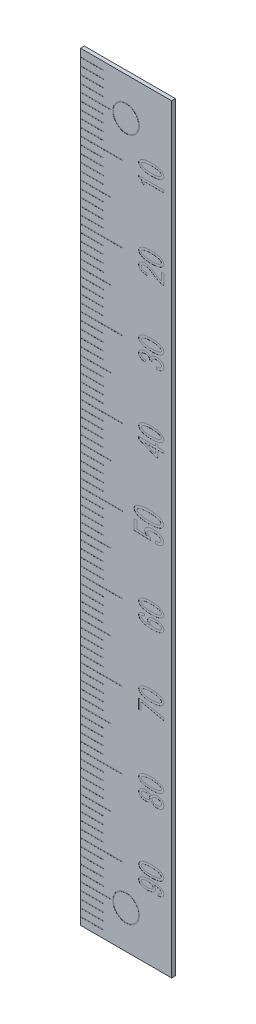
SolidWorks part; units mm, degrees
ref_plane "Front" through (0, 0, 0) normal (0, 0, 1) x (1, 0, 0)
ref_plane "Top" through (0, 0, 0) normal (0, 1, 0) x (1, 0, 0)
ref_plane "Right" through (0, 0, 0) normal (1, 0, 0) x (0, 0, -1)
sketch "Sketch1" plane through (0, 0, 0) normal (0, 0, 1) x (1, 0, 0)
  line L1 (0, 0) -> (0, 100)
  line L2 (0, 0) -> (12, 0)
  line L3 (12, 0) -> (12, 100)
  line L4 (0, 100) -> (12, 100)
  dimension "D1" = 100
  dimension "D2" = 12
extrude "Extrude1" add sketch "Sketch1" along normal blind 0.5
sketch "Sketch2" plane through (0, 0, 0.5) normal (0, 0, 1) x (1, 0, 0)
  line L0 (0, 100) -> (0, 0) construction
  line L1 (0, 0) -> (12, 0) construction
  line L2 (12, 100) -> (0, 100) construction
  circle A0 centre (6, 5) radius 1.75
  circle A1 centre (6, 95) radius 1.75
  circle A2 centre (6, 5) radius 1.65
  circle A3 centre (6, 95) radius 1.65
  dimension "D1" = 6
  dimension "D2" = 6
  dimension "D3" = 5
  dimension "D4" = 5
  dimension "D5" = 3.5
  dimension "D6" = 3.5
  dimension "D7" = 0.1
extrude "Extrude2" cut sketch "Sketch2" against normal blind 0.01
sketch "Sketch3" plane through (0, 0, 0.5) normal (0, 0, 1) x (1, 0, 0)
  line L0 (12, 100) -> (0, 100) construction
  line L1 (7.5, 88.25) -> (11, 88.25) construction
  line L2 (7.5, 88.25) -> (7.5, 91.75) construction
  line L3 (7.5, 91.75) -> (11, 91.75) construction
  line L4 (11, 88.25) -> (11, 91.75) construction
  line L6 (11, 78.25) -> (11, 81.75) construction
  line L7 (11, 68.25) -> (11, 71.75) construction
  line L8 (11, 58.25) -> (11, 61.75) construction
  line L9 (11, 48.25) -> (11, 51.75) construction
  line L10 (11, 38.25) -> (11, 41.75) construction
  line L11 (11, 28.25) -> (11, 31.75) construction
  line L12 (11, 18.25) -> (11, 21.75) construction
  line L13 (11, 8.25) -> (11, 11.75) construction
  line L15 (12, 0) -> (12, 100) construction
  line L16 (11, -1.75) -> (11, 1.75) construction
  text T0 "10" font "ＭＳ ゴシック" height in points 11
  text T1 "20" font "ＭＳ ゴシック" height in points 11
  text T2 "30" font "ＭＳ ゴシック" height in points 11
  text T3 "40" font "ＭＳ ゴシック" height in points 11
  text T4 "50" font "ＭＳ ゴシック" height in points 13
  text T5 "60  " font "ＭＳ ゴシック" height in points 11
  text T6 "70" font "ＭＳ ゴシック" height in points 11
  text T7 "80" font "ＭＳ ゴシック" height in points 11
  text T8 "90" font "ＭＳ ゴシック" height in points 11
  point P4 (11, 90)
  dimension "D1" = 3.5
  dimension "D2" = 10
  dimension "D3" = 1
  dimension "D4" = 3.5
  dimension "D5" = 4
  dimension "D6" = 7
extrude "Extrude3" cut sketch "Sketch3" against normal blind 0.01
sketch "Sketch4" plane through (0, 0, 0.5) normal (0, 0, 1) x (1, 0, 0)
  line L5 (12, 100) -> (0, 100) construction
  line L406 (6, 100) -> (6, 0) construction
  line L407 (0, 0) -> (12, 0) construction
  line L408 (3, 1.05) -> (3, 0.95)
  line L409 (0, 0.95) -> (3, 0.95)
  line L410 (0, 1.05) -> (3, 1.05)
  line L411 (0, 1.05) -> (0, 0.95)
  line L412 (3, 2.05) -> (3, 1.95)
  line L413 (0, 1.95) -> (3, 1.95)
  line L414 (0, 2.05) -> (3, 2.05)
  line L415 (0, 2.05) -> (0, 1.95)
  line L416 (3, 3.05) -> (3, 2.95)
  line L417 (0, 2.95) -> (3, 2.95)
  line L418 (0, 3.05) -> (3, 3.05)
  line L419 (0, 3.05) -> (0, 2.95)
  line L420 (3, 4.05) -> (3, 3.95)
  line L421 (0, 3.95) -> (3, 3.95)
  line L422 (0, 4.05) -> (3, 4.05)
  line L423 (0, 4.05) -> (0, 3.95)
  line L424 (3, 6.05) -> (3, 5.95)
  line L425 (0, 5.95) -> (3, 5.95)
  line L426 (0, 6.05) -> (3, 6.05)
  line L427 (0, 6.05) -> (0, 5.95)
  line L428 (3, 7.05) -> (3, 6.95)
  line L429 (0, 6.95) -> (3, 6.95)
  line L430 (0, 7.05) -> (3, 7.05)
  line L431 (0, 7.05) -> (0, 6.95)
  line L432 (3, 8.05) -> (3, 7.95)
  line L433 (0, 7.95) -> (3, 7.95)
  line L434 (0, 8.05) -> (3, 8.05)
  line L435 (3, 9.05) -> (3, 8.95)
  line L436 (0, 8.95) -> (3, 8.95)
  line L437 (0, 9.05) -> (0, 8.95)
  line L438 (0, 9.05) -> (3, 9.05)
  line L439 (4, 4.95) -> (4, 5.05)
  line L440 (0, 5.05) -> (4, 5.05)
  line L441 (0, 4.95) -> (0, 5.05)
  line L442 (0, 4.95) -> (4, 4.95)
  line L443 (0, 8.05) -> (0, 7.95)
  line L444 (0, 9.95) -> (0, 10.05)
  line L445 (5.5, 9.95) -> (0, 9.95)
  line L446 (5.5, 10.05) -> (5.5, 9.95)
  line L447 (0, 10.05) -> (5.5, 10.05)
  line L448 (3, 11.05) -> (3, 10.95)
  line L449 (0, 10.95) -> (3, 10.95)
  line L450 (0, 11.05) -> (3, 11.05)
  line L451 (0, 11.05) -> (0, 10.95)
  line L452 (3, 12.05) -> (3, 11.95)
  line L453 (0, 11.95) -> (3, 11.95)
  line L454 (0, 12.05) -> (3, 12.05)
  line L455 (0, 12.05) -> (0, 11.95)
  line L456 (3, 13.05) -> (3, 12.95)
  line L457 (0, 12.95) -> (3, 12.95)
  line L458 (0, 13.05) -> (3, 13.05)
  line L459 (0, 13.05) -> (0, 12.95)
  line L460 (3, 14.05) -> (3, 13.95)
  line L461 (0, 13.95) -> (3, 13.95)
  line L462 (0, 14.05) -> (3, 14.05)
  line L463 (0, 14.05) -> (0, 13.95)
  line L464 (3, 16.05) -> (3, 15.95)
  line L465 (0, 15.95) -> (3, 15.95)
  line L466 (0, 16.05) -> (3, 16.05)
  line L467 (0, 16.05) -> (0, 15.95)
  line L468 (3, 17.05) -> (3, 16.95)
  line L469 (0, 16.95) -> (3, 16.95)
  line L470 (0, 17.05) -> (3, 17.05)
  line L471 (0, 17.05) -> (0, 16.95)
  line L472 (3, 18.05) -> (3, 17.95)
  line L473 (0, 17.95) -> (3, 17.95)
  line L474 (0, 18.05) -> (3, 18.05)
  line L475 (3, 19.05) -> (3, 18.95)
  line L476 (0, 18.95) -> (3, 18.95)
  line L477 (0, 19.05) -> (0, 18.95)
  line L478 (0, 19.05) -> (3, 19.05)
  line L479 (4, 14.95) -> (4, 15.05)
  line L480 (0, 15.05) -> (4, 15.05)
  line L481 (0, 14.95) -> (0, 15.05)
  line L482 (0, 14.95) -> (4, 14.95)
  line L483 (0, 18.05) -> (0, 17.95)
  line L484 (0, 19.95) -> (0, 20.05)
  line L485 (5.5, 19.95) -> (0, 19.95)
  line L486 (5.5, 20.05) -> (5.5, 19.95)
  line L487 (0, 20.05) -> (5.5, 20.05)
  line L488 (3, 21.05) -> (3, 20.95)
  line L489 (0, 20.95) -> (3, 20.95)
  line L490 (0, 21.05) -> (3, 21.05)
  line L491 (0, 21.05) -> (0, 20.95)
  line L492 (3, 22.05) -> (3, 21.95)
  line L493 (0, 21.95) -> (3, 21.95)
  line L494 (0, 22.05) -> (3, 22.05)
  line L495 (0, 22.05) -> (0, 21.95)
  line L496 (3, 23.05) -> (3, 22.95)
  line L497 (0, 22.95) -> (3, 22.95)
  line L498 (0, 23.05) -> (3, 23.05)
  line L499 (0, 23.05) -> (0, 22.95)
  line L500 (3, 24.05) -> (3, 23.95)
  line L501 (0, 23.95) -> (3, 23.95)
  line L502 (0, 24.05) -> (3, 24.05)
  line L503 (0, 24.05) -> (0, 23.95)
  line L504 (3, 26.05) -> (3, 25.95)
  line L505 (0, 25.95) -> (3, 25.95)
  line L506 (0, 26.05) -> (3, 26.05)
  line L507 (0, 26.05) -> (0, 25.95)
  line L508 (3, 27.05) -> (3, 26.95)
  line L509 (0, 26.95) -> (3, 26.95)
  line L510 (0, 27.05) -> (3, 27.05)
  line L511 (0, 27.05) -> (0, 26.95)
  line L512 (3, 28.05) -> (3, 27.95)
  line L513 (0, 27.95) -> (3, 27.95)
  line L514 (0, 28.05) -> (3, 28.05)
  line L515 (3, 29.05) -> (3, 28.95)
  line L516 (0, 28.95) -> (3, 28.95)
  line L517 (0, 29.05) -> (0, 28.95)
  line L518 (0, 29.05) -> (3, 29.05)
  line L519 (4, 24.95) -> (4, 25.05)
  line L520 (0, 25.05) -> (4, 25.05)
  line L521 (0, 24.95) -> (0, 25.05)
  line L522 (0, 24.95) -> (4, 24.95)
  line L523 (0, 28.05) -> (0, 27.95)
  line L524 (0, 29.95) -> (0, 30.05)
  line L525 (5.5, 29.95) -> (0, 29.95)
  line L526 (5.5, 30.05) -> (5.5, 29.95)
  line L527 (0, 30.05) -> (5.5, 30.05)
  line L528 (3, 31.05) -> (3, 30.95)
  line L529 (0, 30.95) -> (3, 30.95)
  line L530 (0, 31.05) -> (3, 31.05)
  line L531 (0, 31.05) -> (0, 30.95)
  line L532 (3, 32.05) -> (3, 31.95)
  line L533 (0, 31.95) -> (3, 31.95)
  line L534 (0, 32.05) -> (3, 32.05)
  line L535 (0, 32.05) -> (0, 31.95)
  line L536 (3, 33.05) -> (3, 32.95)
  line L537 (0, 32.95) -> (3, 32.95)
  line L538 (0, 33.05) -> (3, 33.05)
  line L539 (0, 33.05) -> (0, 32.95)
  line L540 (3, 34.05) -> (3, 33.95)
  line L541 (0, 33.95) -> (3, 33.95)
  line L542 (0, 34.05) -> (3, 34.05)
  line L543 (0, 34.05) -> (0, 33.95)
  line L544 (3, 36.05) -> (3, 35.95)
  line L545 (0, 35.95) -> (3, 35.95)
  line L546 (0, 36.05) -> (3, 36.05)
  line L547 (0, 36.05) -> (0, 35.95)
  line L548 (3, 37.05) -> (3, 36.95)
  line L549 (0, 36.95) -> (3, 36.95)
  line L550 (0, 37.05) -> (3, 37.05)
  line L551 (0, 37.05) -> (0, 36.95)
  line L552 (3, 38.05) -> (3, 37.95)
  line L553 (0, 37.95) -> (3, 37.95)
  line L554 (0, 38.05) -> (3, 38.05)
  line L555 (3, 39.05) -> (3, 38.95)
  line L556 (0, 38.95) -> (3, 38.95)
  line L557 (0, 39.05) -> (0, 38.95)
  line L558 (0, 39.05) -> (3, 39.05)
  line L559 (4, 34.95) -> (4, 35.05)
  line L560 (0, 35.05) -> (4, 35.05)
  line L561 (0, 34.95) -> (0, 35.05)
  line L562 (0, 34.95) -> (4, 34.95)
  line L563 (0, 38.05) -> (0, 37.95)
  line L564 (0, 39.95) -> (0, 40.05)
  line L565 (5.5, 39.95) -> (0, 39.95)
  line L566 (5.5, 40.05) -> (5.5, 39.95)
  line L567 (0, 40.05) -> (5.5, 40.05)
  line L568 (3, 41.05) -> (3, 40.95)
  line L569 (0, 40.95) -> (3, 40.95)
  line L570 (0, 41.05) -> (3, 41.05)
  line L571 (0, 41.05) -> (0, 40.95)
  line L572 (3, 42.05) -> (3, 41.95)
  line L573 (0, 41.95) -> (3, 41.95)
  line L574 (0, 42.05) -> (3, 42.05)
  line L575 (0, 42.05) -> (0, 41.95)
  line L576 (3, 43.05) -> (3, 42.95)
  line L577 (0, 42.95) -> (3, 42.95)
  line L578 (0, 43.05) -> (3, 43.05)
  line L579 (0, 43.05) -> (0, 42.95)
  line L580 (3, 44.05) -> (3, 43.95)
  line L581 (0, 43.95) -> (3, 43.95)
  line L582 (0, 44.05) -> (3, 44.05)
  line L583 (0, 44.05) -> (0, 43.95)
  line L584 (3, 46.05) -> (3, 45.95)
  line L585 (0, 45.95) -> (3, 45.95)
  line L586 (0, 46.05) -> (3, 46.05)
  line L587 (0, 46.05) -> (0, 45.95)
  line L588 (3, 47.05) -> (3, 46.95)
  line L589 (0, 46.95) -> (3, 46.95)
  line L590 (0, 47.05) -> (3, 47.05)
  line L591 (0, 47.05) -> (0, 46.95)
  line L592 (3, 48.05) -> (3, 47.95)
  line L593 (0, 47.95) -> (3, 47.95)
  line L594 (0, 48.05) -> (3, 48.05)
  line L595 (3, 49.05) -> (3, 48.95)
  line L596 (0, 48.95) -> (3, 48.95)
  line L597 (0, 49.05) -> (0, 48.95)
  line L598 (0, 49.05) -> (3, 49.05)
  line L599 (4, 44.95) -> (4, 45.05)
  line L600 (0, 45.05) -> (4, 45.05)
  line L601 (0, 44.95) -> (0, 45.05)
  line L602 (0, 44.95) -> (4, 44.95)
  line L603 (0, 48.05) -> (0, 47.95)
  line L604 (3, 51.05) -> (3, 50.95)
  line L605 (0, 50.95) -> (3, 50.95)
  line L606 (0, 51.05) -> (3, 51.05)
  line L607 (0, 51.05) -> (0, 50.95)
  line L608 (3, 52.05) -> (3, 51.95)
  line L609 (0, 51.95) -> (3, 51.95)
  line L610 (0, 52.05) -> (3, 52.05)
  line L611 (0, 52.05) -> (0, 51.95)
  line L612 (3, 53.05) -> (3, 52.95)
  line L613 (0, 52.95) -> (3, 52.95)
  line L614 (0, 53.05) -> (3, 53.05)
  line L615 (0, 53.05) -> (0, 52.95)
  line L616 (3, 54.05) -> (3, 53.95)
  line L617 (0, 53.95) -> (3, 53.95)
  line L618 (0, 54.05) -> (3, 54.05)
  line L619 (0, 54.05) -> (0, 53.95)
  line L620 (3, 56.05) -> (3, 55.95)
  line L621 (0, 55.95) -> (3, 55.95)
  line L622 (0, 56.05) -> (3, 56.05)
  line L623 (0, 56.05) -> (0, 55.95)
  line L624 (3, 57.05) -> (3, 56.95)
  line L625 (0, 56.95) -> (3, 56.95)
  line L626 (0, 57.05) -> (3, 57.05)
  line L627 (0, 57.05) -> (0, 56.95)
  line L628 (3, 58.05) -> (3, 57.95)
  line L629 (0, 57.95) -> (3, 57.95)
  line L630 (0, 58.05) -> (3, 58.05)
  line L631 (3, 59.05) -> (3, 58.95)
  line L632 (0, 58.95) -> (3, 58.95)
  line L633 (0, 59.05) -> (0, 58.95)
  line L634 (0, 59.05) -> (3, 59.05)
  line L635 (4, 54.95) -> (4, 55.05)
  line L636 (0, 55.05) -> (4, 55.05)
  line L637 (0, 54.95) -> (0, 55.05)
  line L638 (0, 54.95) -> (4, 54.95)
  line L639 (0, 58.05) -> (0, 57.95)
  line L640 (0, 49.95) -> (0, 50.05)
  line L641 (5.5, 49.95) -> (0, 49.95)
  line L642 (5.5, 50.05) -> (5.5, 49.95)
  line L643 (0, 50.05) -> (5.5, 50.05)
  line L644 (3, 61.05) -> (3, 60.95)
  line L645 (0, 60.95) -> (3, 60.95)
  line L646 (0, 61.05) -> (3, 61.05)
  line L647 (0, 61.05) -> (0, 60.95)
  line L648 (3, 62.05) -> (3, 61.95)
  line L649 (0, 61.95) -> (3, 61.95)
  line L650 (0, 62.05) -> (3, 62.05)
  line L651 (0, 62.05) -> (0, 61.95)
  line L652 (3, 63.05) -> (3, 62.95)
  line L653 (0, 62.95) -> (3, 62.95)
  line L654 (0, 63.05) -> (3, 63.05)
  line L655 (0, 63.05) -> (0, 62.95)
  line L656 (3, 64.05) -> (3, 63.95)
  line L657 (0, 63.95) -> (3, 63.95)
  line L658 (0, 64.05) -> (3, 64.05)
  line L659 (0, 64.05) -> (0, 63.95)
  line L660 (3, 66.05) -> (3, 65.95)
  line L661 (0, 65.95) -> (3, 65.95)
  line L662 (0, 66.05) -> (3, 66.05)
  line L663 (0, 66.05) -> (0, 65.95)
  line L664 (3, 67.05) -> (3, 66.95)
  line L665 (0, 66.95) -> (3, 66.95)
  line L666 (0, 67.05) -> (3, 67.05)
  line L667 (0, 67.05) -> (0, 66.95)
  line L668 (3, 68.05) -> (3, 67.95)
  line L669 (0, 67.95) -> (3, 67.95)
  line L670 (0, 68.05) -> (3, 68.05)
  line L671 (3, 69.05) -> (3, 68.95)
  line L672 (0, 68.95) -> (3, 68.95)
  line L673 (0, 69.05) -> (0, 68.95)
  line L674 (0, 69.05) -> (3, 69.05)
  line L675 (4, 64.95) -> (4, 65.05)
  line L676 (0, 65.05) -> (4, 65.05)
  line L677 (0, 64.95) -> (0, 65.05)
  line L678 (0, 64.95) -> (4, 64.95)
  line L679 (0, 68.05) -> (0, 67.95)
  line L680 (0, 59.95) -> (0, 60.05)
  line L681 (5.5, 59.95) -> (0, 59.95)
  line L682 (5.5, 60.05) -> (5.5, 59.95)
  line L683 (0, 60.05) -> (5.5, 60.05)
  line L684 (3, 71.05) -> (3, 70.95)
  line L685 (0, 70.95) -> (3, 70.95)
  line L686 (0, 71.05) -> (3, 71.05)
  line L687 (0, 71.05) -> (0, 70.95)
  line L688 (3, 72.05) -> (3, 71.95)
  line L689 (0, 71.95) -> (3, 71.95)
  line L690 (0, 72.05) -> (3, 72.05)
  line L691 (0, 72.05) -> (0, 71.95)
  line L692 (3, 73.05) -> (3, 72.95)
  line L693 (0, 72.95) -> (3, 72.95)
  line L694 (0, 73.05) -> (3, 73.05)
  line L695 (0, 73.05) -> (0, 72.95)
  line L696 (3, 74.05) -> (3, 73.95)
  line L697 (0, 73.95) -> (3, 73.95)
  line L698 (0, 74.05) -> (3, 74.05)
  line L699 (0, 74.05) -> (0, 73.95)
  line L700 (3, 76.05) -> (3, 75.95)
  line L701 (0, 75.95) -> (3, 75.95)
  line L702 (0, 76.05) -> (3, 76.05)
  line L703 (0, 76.05) -> (0, 75.95)
  line L704 (3, 77.05) -> (3, 76.95)
  line L705 (0, 76.95) -> (3, 76.95)
  line L706 (0, 77.05) -> (3, 77.05)
  line L707 (0, 77.05) -> (0, 76.95)
  line L708 (3, 78.05) -> (3, 77.95)
  line L709 (0, 77.95) -> (3, 77.95)
  line L710 (0, 78.05) -> (3, 78.05)
  line L711 (3, 79.05) -> (3, 78.95)
  line L712 (0, 78.95) -> (3, 78.95)
  line L713 (0, 79.05) -> (0, 78.95)
  line L714 (0, 79.05) -> (3, 79.05)
  line L715 (4, 74.95) -> (4, 75.05)
  line L716 (0, 75.05) -> (4, 75.05)
  line L717 (0, 74.95) -> (0, 75.05)
  line L718 (0, 74.95) -> (4, 74.95)
  line L719 (0, 78.05) -> (0, 77.95)
  line L720 (0, 69.95) -> (0, 70.05)
  line L721 (5.5, 69.95) -> (0, 69.95)
  line L722 (5.5, 70.05) -> (5.5, 69.95)
  line L723 (0, 70.05) -> (5.5, 70.05)
  line L724 (3, 81.05) -> (3, 80.95)
  line L725 (0, 80.95) -> (3, 80.95)
  line L726 (0, 81.05) -> (3, 81.05)
  line L727 (0, 81.05) -> (0, 80.95)
  line L728 (3, 82.05) -> (3, 81.95)
  line L729 (0, 81.95) -> (3, 81.95)
  line L730 (0, 82.05) -> (3, 82.05)
  line L731 (0, 82.05) -> (0, 81.95)
  line L732 (3, 83.05) -> (3, 82.95)
  line L733 (0, 82.95) -> (3, 82.95)
  line L734 (0, 83.05) -> (3, 83.05)
  line L735 (0, 83.05) -> (0, 82.95)
  line L736 (3, 84.05) -> (3, 83.95)
  line L737 (0, 83.95) -> (3, 83.95)
  line L738 (0, 84.05) -> (3, 84.05)
  line L739 (0, 84.05) -> (0, 83.95)
  line L740 (3, 86.05) -> (3, 85.95)
  line L741 (0, 85.95) -> (3, 85.95)
  line L742 (0, 86.05) -> (3, 86.05)
  line L743 (0, 86.05) -> (0, 85.95)
  line L744 (3, 87.05) -> (3, 86.95)
  line L745 (0, 86.95) -> (3, 86.95)
  line L746 (0, 87.05) -> (3, 87.05)
  line L747 (0, 87.05) -> (0, 86.95)
  line L748 (3, 88.05) -> (3, 87.95)
  line L749 (0, 87.95) -> (3, 87.95)
  line L750 (0, 88.05) -> (3, 88.05)
  line L751 (3, 89.05) -> (3, 88.95)
  line L752 (0, 88.95) -> (3, 88.95)
  line L753 (0, 89.05) -> (0, 88.95)
  line L754 (0, 89.05) -> (3, 89.05)
  line L755 (4, 84.95) -> (4, 85.05)
  line L756 (0, 85.05) -> (4, 85.05)
  line L757 (0, 84.95) -> (0, 85.05)
  line L758 (0, 84.95) -> (4, 84.95)
  line L759 (0, 88.05) -> (0, 87.95)
  line L760 (3, 91.05) -> (3, 90.95)
  line L761 (0, 90.95) -> (3, 90.95)
  line L762 (0, 91.05) -> (3, 91.05)
  line L763 (0, 91.05) -> (0, 90.95)
  line L764 (3, 92.05) -> (3, 91.95)
  line L765 (0, 91.95) -> (3, 91.95)
  line L766 (0, 92.05) -> (3, 92.05)
  line L767 (0, 92.05) -> (0, 91.95)
  line L768 (3, 93.05) -> (3, 92.95)
  line L769 (0, 92.95) -> (3, 92.95)
  line L770 (0, 93.05) -> (3, 93.05)
  line L771 (0, 93.05) -> (0, 92.95)
  line L772 (3, 94.05) -> (3, 93.95)
  line L773 (0, 93.95) -> (3, 93.95)
  line L774 (0, 94.05) -> (3, 94.05)
  line L775 (0, 94.05) -> (0, 93.95)
  line L776 (0, 79.95) -> (0, 80.05)
  line L777 (5.5, 79.95) -> (0, 79.95)
  line L778 (5.5, 80.05) -> (5.5, 79.95)
  line L779 (0, 80.05) -> (5.5, 80.05)
  line L780 (3, 96.05) -> (3, 95.95)
  line L781 (0, 95.95) -> (3, 95.95)
  line L782 (0, 96.05) -> (3, 96.05)
  line L783 (0, 96.05) -> (0, 95.95)
  line L784 (3, 97.05) -> (3, 96.95)
  line L785 (0, 96.95) -> (3, 96.95)
  line L786 (0, 97.05) -> (3, 97.05)
  line L787 (0, 97.05) -> (0, 96.95)
  line L788 (3, 98.05) -> (3, 97.95)
  line L789 (0, 97.95) -> (3, 97.95)
  line L790 (0, 98.05) -> (3, 98.05)
  line L791 (3, 99.05) -> (3, 98.95)
  line L792 (0, 98.95) -> (3, 98.95)
  line L793 (0, 99.05) -> (0, 98.95)
  line L794 (0, 99.05) -> (3, 99.05)
  line L795 (4, 94.95) -> (4, 95.05)
  line L796 (0, 95.05) -> (4, 95.05)
  line L797 (0, 94.95) -> (0, 95.05)
  line L798 (0, 94.95) -> (4, 94.95)
  line L799 (0, 98.05) -> (0, 97.95)
  line L800 (0, 89.95) -> (0, 90.05)
  line L801 (5.5, 89.95) -> (0, 89.95)
  line L802 (5.5, 90.05) -> (5.5, 89.95)
  line L803 (0, 90.05) -> (5.5, 90.05)
extrude "Extrude4" cut sketch "Sketch4" against normal blind 0.01
move or copy body "Body-Move/Copy2" bodies to move or copy 105 copy no translate (-12, -50, 0)
move or copy body "Body-Move/Copy3" bodies to move or copy 107 copy no translate (0, -50, 0)
